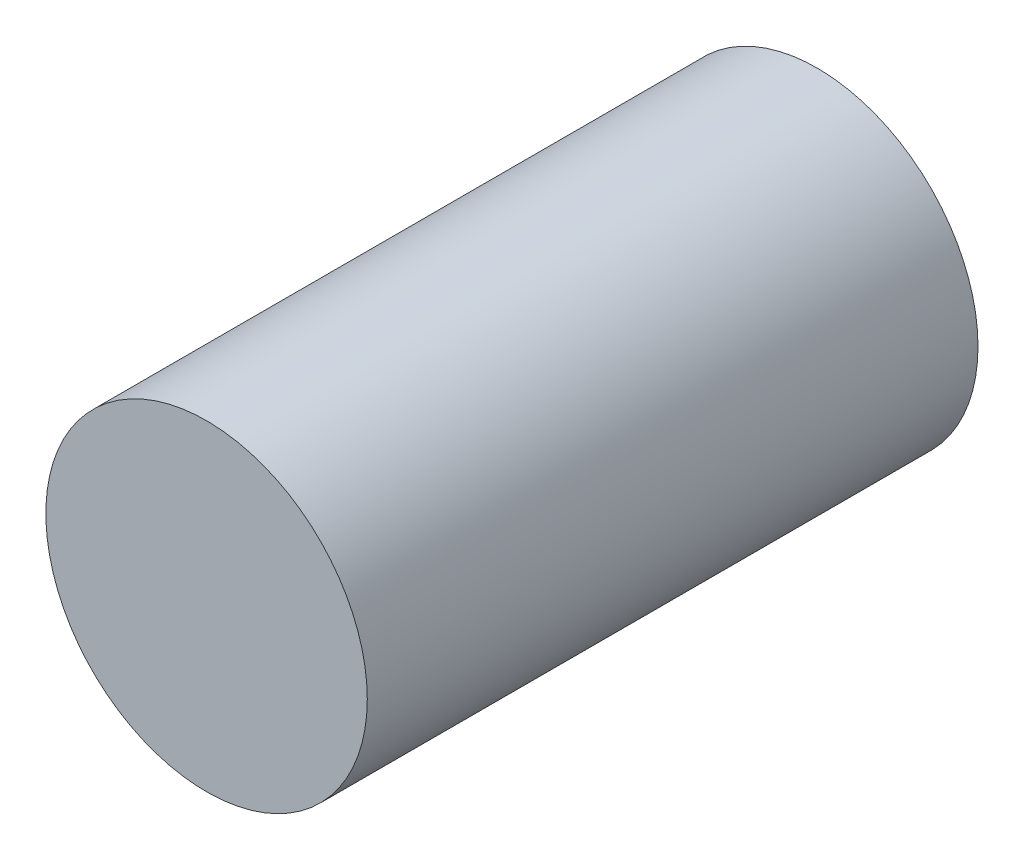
SolidWorks part; units mm, degrees
ref_plane "Front Plane" through (0, 0, 0) normal (0, 0, 1) x (1, 0, 0)
ref_plane "Top Plane" through (0, 0, 0) normal (0, 1, 0) x (1, 0, 0)
ref_plane "Right Plane" through (0, 0, 0) normal (1, 0, 0) x (0, 0, -1)
sketch "Sketch1" plane through (0, 0, 0) normal (0, 0, 1) x (1, 0, 0)
  circle A0 centre (0, 0) radius 25
  dimension "D1" = 50
extrude "Boss-Extrude1" add sketch "Sketch1" along normal blind 95
